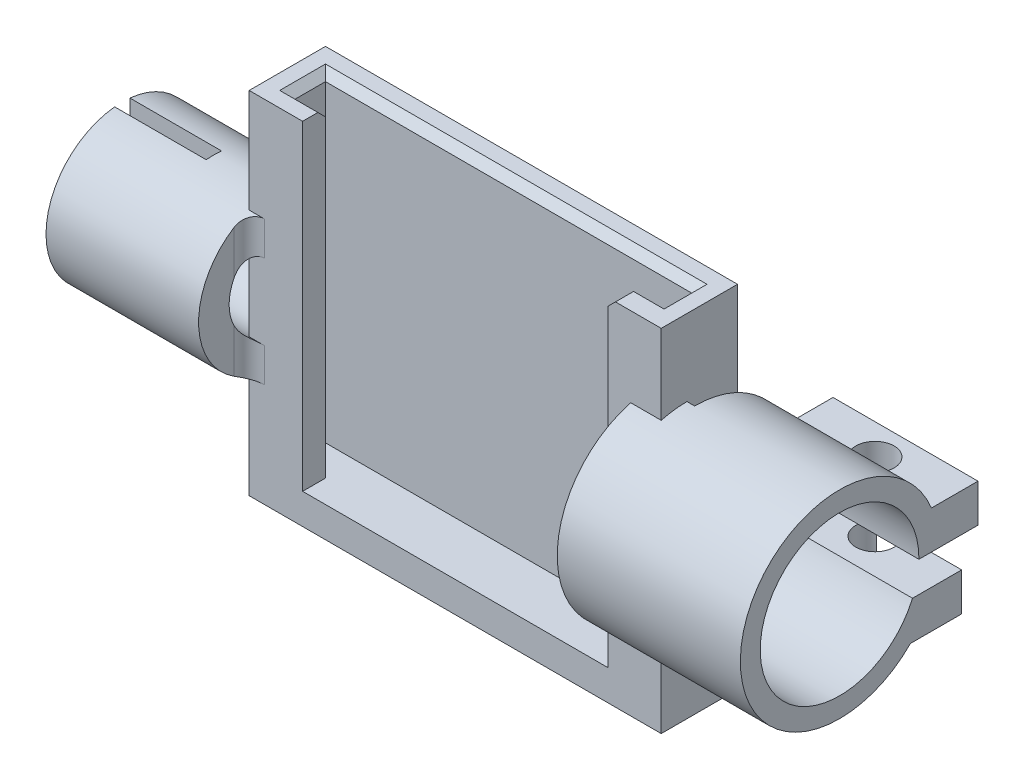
SolidWorks part; units mm, degrees
ref_plane "Plan de face" through (0, 0, 0) normal (0, 0, 1) x (1, 0, 0)
ref_plane "Plan de dessus" through (0, 0, 0) normal (0, 1, 0) x (1, 0, 0)
ref_plane "Plan de droite" through (0, 0, 0) normal (1, 0, 0) x (0, 0, -1)
sketch "Esquisse1" plane through (0, 0, 0) normal (0, 0, 1) x (1, 0, 0)
  line L1 (-27, 23) -> (0, 23)
  line L2 (-27, 23) -> (-27, 0)
  line L3 (-27, 0) -> (0, 0)
  line L4 (0, 23) -> (0, 0)
  dimension "D1" = 23
  dimension "D2" = 27
extrude "Boss.-Extru.1" add sketch "Esquisse1" along normal blind 5
sketch "Esquisse2" plane through (0, 23, 0) normal (0, 1, 0) x (1, 0, 0)
  line L0 (-13.5, 7.4562) -> (-13.5, -10.3121) construction
  line L1 (-23.5, -3.5) -> (-23.5, -8.6173)
  line L3 (-23.5, -3.5) -> (-25.5, -3.5)
  line L4 (-25.5, -3.5) -> (-25.5, -1.5)
  line L5 (-25.5, -1.5) -> (-1.5, -1.5)
  line L6 (-1.5, -1.5) -> (-1.5, -3.3141)
  line L7 (-1.5, -3.3141) -> (-3.5, -3.3141)
  line L8 (-3.5, -3.3141) -> (-3.5, -6.8678)
  line L9 (-23.5, -8.6173) -> (-3.5, -6.8678)
  line L11 (0, 0) -> (-27, 0) construction
  line L12 (0, -5) -> (0, 0) construction
  dimension "D1" = 1.5
  dimension "D2" = 2
  dimension "D3" = 1.5
  dimension "D4" = 24
  dimension "D5" = 12
  dimension "D6" = 10
extrude "Enlèv. mat.-Extru.2" cut sketch "Esquisse2" against normal blind 21
chamfer "Chanfrein1" distance 0.5 angle 45 6 edges at (-3.5, 23, 4.1571) (-2.5, 23, 3.3141) (-1.5, 23, 2.4071) (-13.5, 23, 1.5) (-25.5, 23, 2.5) (-24.5, 23, 3.5)
ref_plane "Plan1" through (-13.5, 0, 0) normal (1, 0, 0) x (0, 0, -1)
sketch "Esquisse11" plane through (0, 0, 3.3141) normal (0, 0, -1) x (-1, 0, 0)
  line L0 (27, 11.5) -> (37, 11.5) construction
  line L1 (27, 23) -> (27, 0) construction
  line L4 (27, 14.5) -> (37, 14.5)
  line L5 (27, 14.5) -> (27, 16.5)
  line L6 (27, 16.5) -> (37, 16.5)
  line L7 (37, 14.5) -> (37, 16.5)
  dimension "D1" = 6
  dimension "D2" = 10
  dimension "D3" = 10
revolve "Révolution2" add sketch "Esquisse11" angle 360 about L0
fillet "Congé7" radius 1 3 edges at (-27, 11.5, 0) (-27, 15.0943, 5) (-27, 7.9057, 5)
sketch "Esquisse13" plane through (0, 0, 0) normal (0, 1, 0) x (1, 0, 0)
  line L0 (-37, -3.3141) -> (-27, -3.3141) construction
  line L1 (-38.4181, -2.8141) -> (-31, -2.8141)
  line L2 (-38.4181, -2.8141) -> (-38.4181, -3.8141)
  line L3 (-38.4181, -3.8141) -> (-31, -3.8141)
  line L4 (-31, -2.8141) -> (-31, -3.8141)
  line L5 (-37, 1.6859) -> (-37, -8.3141) construction
  dimension "D1" = 1
  dimension "D2" = 0.5
  dimension "D3" = 6
extrude "Enlèv. mat.-Extru.12" cut sketch "Esquisse13" along normal through all
sketch "Esquisse14" plane through (0, 0, 0) normal (1, 0, 0) x (0, 0, -1)
  line L5 (1.3278, 6.95) -> (4.6859, 6.95)
  line L6 (4.6859, 6.95) -> (4.6859, 9.45)
  line L7 (4.6859, 9.45) -> (1.4647, 9.45)
  line L9 (2.7065, 13.95) -> (5.7571, 13.95)
  line L11 (5.7571, 13.95) -> (5.7571, 11.45)
  line L14 (5.7571, 11.45) -> (1.8856, 11.45)
  arc A0 (-8.5141, 7.6) -> (1.3278, 6.95) centre (-3.3141, 11.5) ccw
  arc A1 (-6, 15.7173) -> (-6, 7.2827) centre (-3.3141, 11.5) ccw construction
  arc A2 (1.8856, 11.45) -> (1.4647, 9.45) centre (-3.3141, 11.5) ccw
  arc A3 (2.7065, 13.95) -> (-8.5141, 7.6) centre (-3.3141, 11.5) ccw
  dimension "D1" = 5.2
  dimension "D2" = 6.5
  dimension "D3" = 2.5
  dimension "D4" = 2
  dimension "D5" = 7
  dimension "D6" = 8
extrude "Boss.-Extru.5" add sketch "Esquisse14" along normal blind 10
sketch "Esquisse15" plane through (0, 23, 0) normal (0, 1, 0) x (1, 0, 0)
  line L0 (10, -3.3141) -> (0, -3.3141) construction
  line L1 (0, -3.3141) -> (0.5, -3.3141)
  line L2 (0, -3.3141) -> (0, 7.0595)
  line L3 (0, 7.0595) -> (0.5, 7.0595)
  line L4 (0.5, -3.3141) -> (0.5, 7.0595)
  line L5 (0, -5) -> (0, 0) construction
  line L6 (10, 5.7571) -> (0, 5.7571) construction
  line L7 (10, 1.3278) -> (10, 4.6859) construction
  circle A1 centre (5.25, 3.7571) radius 1.25
  point P14 (10, 3.0068)
  dimension "D2" = 2.5
  dimension "D1" = 0.5
  dimension "D4" = 2
  dimension "D5" = 4.75
extrude "Enlèv. mat.-Extru.15" cut sketch "Esquisse15" against normal through all
sketch "Esquisse17" plane through (0, 0, 0) normal (-1, 0, 0) x (0, 0, 1)
  line L0 (5, 5.2224) -> (5, 6.5809)
  line L1 (5, 16.4191) -> (5, 17.7776) construction
  line L2 (5, 16.4191) -> (5, 17.7776)
  arc A0 (5, 6.5809) -> (5, 16.4191) centre (3.3141, 11.5) ccw
  arc A1 (5, 5.2224) -> (5, 17.7776) centre (3.3141, 11.5) ccw
  arc A3 (5, 6.5809) -> (5, 16.4191) centre (3.3141, 11.5) ccw construction
  arc A4 (5, 5.2224) -> (5, 17.7776) centre (3.3141, 11.5) ccw construction
extrude "Boss.-Extru.6" add sketch "Esquisse17" along normal blind 2
